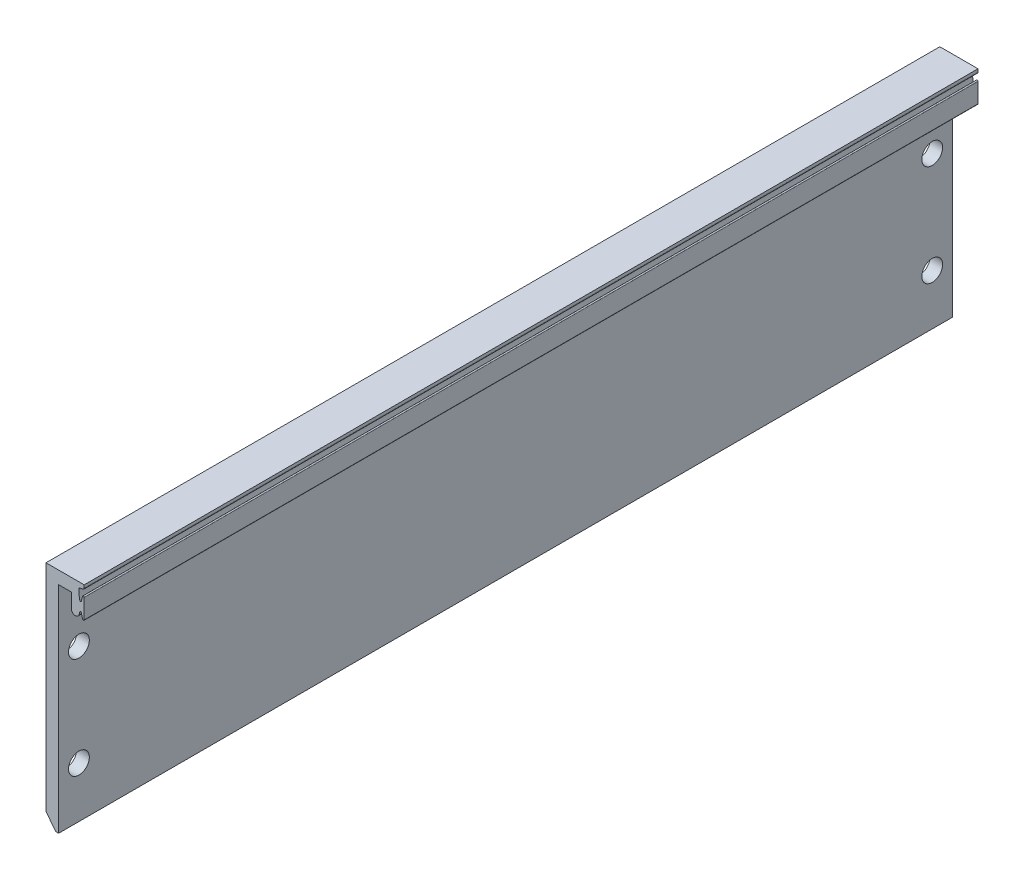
SolidWorks part; units mm, degrees
ref_plane "前视基准面" through (0, 0, 0) normal (0, 0, 1) x (1, 0, 0)
ref_plane "上视基准面" through (0, 0, 0) normal (0, 1, 0) x (1, 0, 0)
ref_plane "右视基准面" through (0, 0, 0) normal (1, 0, 0) x (0, 0, -1)
sketch "草图1" plane through (0, 0, 0) normal (0, 0, 1) x (1, 0, 0)
  line L3 (2260.201, -3063.3015) -> (2260.201, -3066.1678)
  line L4 (2262.741, -3060.8015) -> (2262.741, -3061.3761)
  line L6 (2261.7412, -3066.3727) -> (2261.8863, -3065.8372)
  line L7 (2262.1766, -3065.8405) -> (2262.4208, -3066.828)
  line L8 (2262.741, -3066.789) -> (2262.741, -3062.964)
  line L9 (2262.4208, -3062.925) -> (2262.1766, -3063.9125)
  line L10 (2261.9399, -3061.7612) -> (2262.489, -3061.6723)
  line L11 (2262.741, -3061.3761) -> (2262.741, -3060.8015)
  line L12 (2262.741, -3060.8015) -> (2255.201, -3060.8015)
  line L13 (2255.201, -3060.8015) -> (2255.201, -3103.3015)
  line L14 (2255.201, -3103.3015) -> (2257.101, -3105.8015)
  line L15 (2257.101, -3105.8015) -> (2257.701, -3105.8015)
  line L16 (2257.701, -3105.8015) -> (2257.701, -3063.3015)
  line L17 (2257.701, -3063.3015) -> (2260.201, -3063.3015)
  line L18 (2260.201, -3063.3015) -> (2260.201, -3066.1678)
  arc A0 (2260.201, -3066.1678) -> (2261.7412, -3066.3727) centre (2260.9847, -3066.1678) ccw
  arc A1 (2262.1766, -3065.8405) -> (2261.8863, -3065.8372) centre (2262.031, -3065.8765) ccw
  arc A2 (2262.4208, -3066.828) -> (2262.741, -3066.789) centre (2262.5785, -3066.789) ccw
  arc A3 (2262.741, -3062.964) -> (2262.4208, -3062.925) centre (2262.5785, -3062.964) ccw
  arc A4 (2261.8821, -3063.894) -> (2262.1766, -3063.9125) centre (2262.031, -3063.8765) ccw
  arc A5 (2261.6881, -3062.0453) -> (2261.8821, -3063.894) centre (2268.1291, -3062.304) ccw
  arc A6 (2261.9399, -3061.7612) -> (2261.6881, -3062.0453) centre (2261.9878, -3062.0573) ccw
  arc A7 (2262.489, -3061.6723) -> (2262.741, -3061.3761) centre (2262.441, -3061.3761) ccw
extrude "凸台-拉伸1" add sketch "草图1" along normal mid plane 176.45 contours L10 A7 L4 L12 L13 L14 L15 L16 L17 L3 A0 L6 A1 L7 A2 L8 A3 L9 A4 A5 A6
sketch "草图2" plane through (2255.201, 0, 0) normal (-1, 0, 0) x (0, 0, 1)
  line L0 (88.225, -3060.8015) -> (-88.225, -3060.8015) construction
  line L1 (-88.225, -3060.8015) -> (-88.225, -3103.3015) construction
  line L2 (0, -3060.8015) -> (0, -3105.8015) construction
  line L3 (88.225, -3105.8015) -> (-88.225, -3105.8015) construction
  circle A0 centre (-84.225, -3075.8015) radius 2.05
  circle A1 centre (-84.225, -3095.8015) radius 2.05
  circle A2 centre (84.225, -3095.8015) radius 2.05
  circle A3 centre (84.225, -3075.8015) radius 2.05
  dimension "D1" = 4.1
  dimension "D2" = 4.1
  dimension "D3" = 20
  dimension "D4" = 15
  dimension "D5" = 4
  dimension "D6" = 4
extrude "切除-拉伸1" cut sketch "草图2" against normal through all
sketch "草图3" plane through (2255.201, 0, 0) normal (-1, 0, 0) x (0, 0, 1)
  line L0 (-88.225, -3060.8015) -> (-88.225, -3103.3015) construction
  line L1 (88.225, -3060.8015) -> (-88.225, -3060.8015) construction
  circle A0 centre (39.775, -3075.8015) radius 2.05
  circle A1 centre (49.125, -3075.8015) radius 2.05
  circle A2 centre (49.125, -3095.8015) radius 2.05
  circle A3 centre (39.775, -3095.8015) radius 2.05
  point P4 (0, -3060.8015)
  dimension "D1" = 4.1
  dimension "D2" = 128
  dimension "D3" = 15
  dimension "D4" = 2
  dimension "D5" = 2
extrude "切除-拉伸2" [suppressed] cut sketch "草图3" against normal through all
equation "\"切除-拉伸2\" = if ( \"D1@凸台-拉伸1\" = 265.35 , \"unsuppressed\" , \"suppressed\" )"
